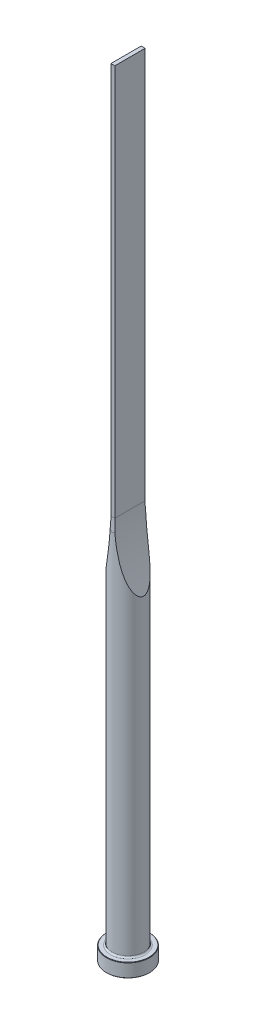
SolidWorks part; units mm, degrees
ref_plane "Front Plane" through (0, 0, 0) normal (0, 0, 1) x (1, 0, 0)
ref_plane "Top Plane" through (0, 0, 0) normal (0, 1, 0) x (1, 0, 0)
ref_plane "Right Plane" through (0, 0, 0) normal (1, 0, 0) x (0, 0, -1)
sketch "Sketch1" plane through (0, 0, 0) normal (0, 0, 1) x (1, 0, 0)
  line L0 (0, 0) -> (10.8, 0)
  line L1 (55, 0) -> (-55, 0) construction
  line L2 (11, 0.2) -> (11, 6.8)
  line L3 (10.8, 7) -> (8.8, 7)
  line L4 (8, 7.8) -> (8, 400)
  line L5 (0, 400) -> (8, 400)
  line L6 (11, 6.8) -> (10.8, 7)
  line L7 (10.8, 0) -> (11, 0.2)
  line L8 (0, 400) -> (0, 0)
  arc A0 (8, 7.8) -> (8.8, 7) centre (8.8, 7.8) ccw
  point P1 (11, 0)
  point P6 (11, 7)
  dimension "D4" = 0.8
  dimension "D1" = 8
  dimension "D2" = 11
  dimension "D3" = 7
  dimension "D5" = 400
revolve "Revolve1" add sketch "Sketch1" angle 360 about L8
sketch "Sketch2" plane through (0, 0, 0) normal (0, 0, 1) x (1, 0, 0)
  line L0 (1, 400) -> (1, 200)
  line L1 (8, 400) -> (-8, 400) construction
  line L2 (-1, 400) -> (-1, 200)
  line L3 (8, 400) -> (8, 165.2006)
  line L4 (-8, 400) -> (-8, 165.2006)
  line L5 (0, -12.1) -> (0, 12.1) construction
  line L6 (8, 400) -> (1, 400)
  line L8 (-1, 400) -> (-8, 400)
  arc A0 (1, 200) -> (8, 165.2006) centre (91, 200) ccw
  arc A1 (-1, 200) -> (-8, 165.2006) centre (-91, 200) cw
  dimension "D4" = 90
  dimension "D1" = 200
  dimension "D2" = 2
  dimension "D3" = 1
extrude "Cut-Extrude1" cut sketch "Sketch2" against normal mid plane 20
sketch "Sketch3" plane through (0, 0, 0) normal (1, 0, 0) x (0, 0, -1)
  line L0 (7.75, 400) -> (7.75, 200)
  line L1 (-7.9373, 400) -> (7.9373, 400) construction
  line L2 (-7.75, 400) -> (-7.75, 200)
  line L3 (8, 400) -> (8, 193.2965)
  line L4 (7.75, 400) -> (8, 400)
  line L5 (0, 12.1) -> (0, -12.1) construction
  line L6 (-8, 400) -> (-8, 193.2965)
  line L8 (-7.75, 400) -> (-8, 400)
  arc A0 (7.75, 200) -> (8, 193.2965) centre (97.75, 200) ccw
  arc A1 (-7.75, 200) -> (-8, 193.2965) centre (-97.75, 200) cw
  dimension "D2" = 90
  dimension "D1" = 200
  dimension "D3" = 15.5
  dimension "D4" = 7.75
extrude "Cut-Extrude2" cut sketch "Sketch3" against normal mid plane 20
